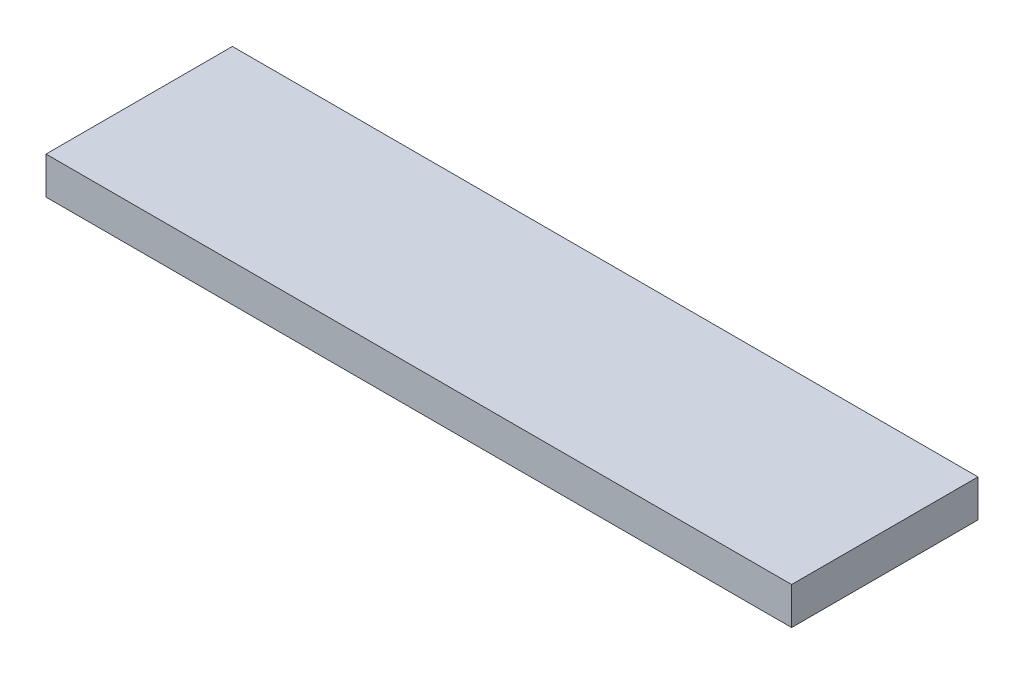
SolidWorks part; units mm, degrees
ref_plane "Front Plane" through (0, 0, 0) normal (0, 0, 1) x (1, 0, 0)
ref_plane "Top Plane" through (0, 0, 0) normal (0, 1, 0) x (1, 0, 0)
ref_plane "Right Plane" through (0, 0, 0) normal (1, 0, 0) x (0, 0, -1)
sketch "Sketch1" plane through (0, 0, 0) normal (1, 0, 0) x (0, 0, -1)
  line L1 (0, 0) -> (25, 0)
  line L2 (0, 0) -> (0, 5)
  line L3 (0, 5) -> (25, 5)
  line L4 (25, 0) -> (25, 5)
  dimension "D1" = 5
  dimension "D2" = 25
extrude "Boss-Extrude1" add sketch "Sketch1" along normal blind 100 contours L2 L1 L4 L3
